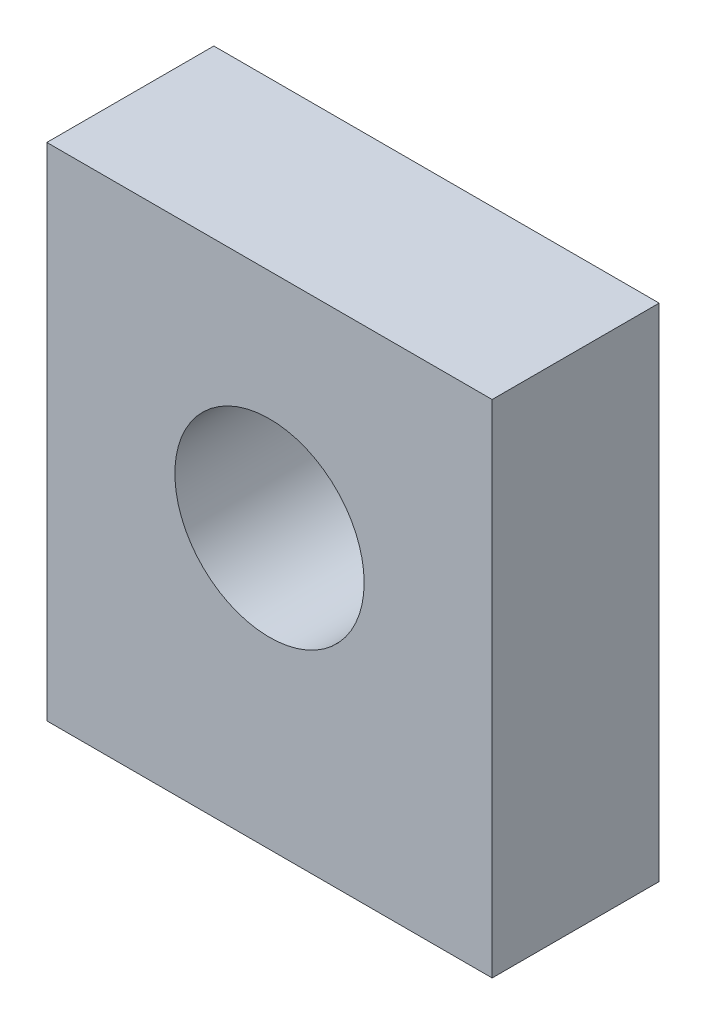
SolidWorks part; units mm, degrees
ref_plane "前视基准面" through (0, 0, 0) normal (0, 0, 1) x (1, 0, 0)
ref_plane "上视基准面" through (0, 0, 0) normal (0, 1, 0) x (1, 0, 0)
ref_plane "右视基准面" through (0, 0, 0) normal (1, 0, 0) x (0, 0, -1)
other "Configuration Table"
sketch "草图1" plane through (0, 0, 0) normal (0, 0, 1) x (1, 0, 0)
  line L0 (-4, -5) -> (4, -5)
  line L1 (4, -5) -> (4, 4)
  line L2 (4, 4) -> (-4, 4)
  line L3 (-4, 4) -> (-4, -5)
  circle A0 centre (0, 0) radius 1.7
  dimension "D1" = 3.4
  dimension "D2" = 4
  dimension "D3" = 4
  dimension "D4" = 4
  dimension "D5" = 5
extrude "Clip_M3_clearance" add sketch "草图1" along normal blind 3
